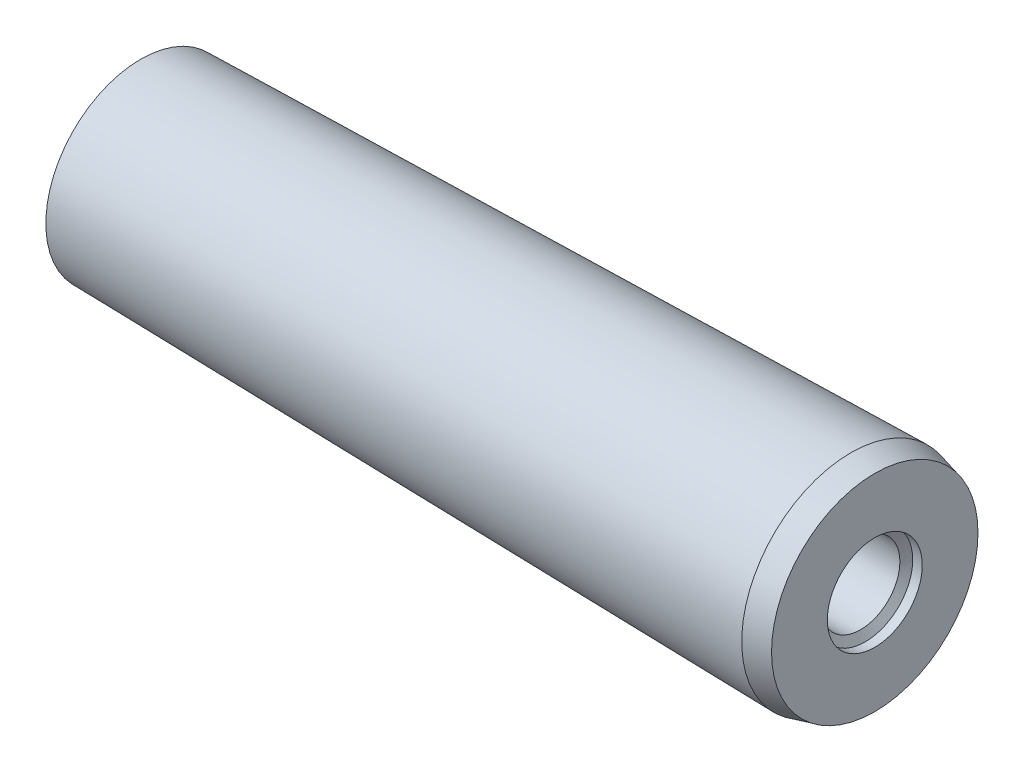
SolidWorks part; units mm, degrees
ref_plane "Front Plane" through (0, 0, 0) normal (0, 0, 1) x (1, 0, 0)
ref_plane "Top Plane" through (0, 0, 0) normal (0, 1, 0) x (1, 0, 0)
ref_plane "Right Plane" through (0, 0, 0) normal (1, 0, 0) x (0, 0, -1)
sketch "BodySke" plane through (0, 0, 0) normal (0, 0, 1) x (1, 0, 0)
  line L0 (0, 0) -> (-250, 0) construction
  line L1 (0, 0) -> (0, 5) construction
  line L2 (0, 5) -> (-250, 0) construction
  line L3 (-200, 0) -> (-55.9767, 0)
  line L4 (-6.3, 28.74) -> (-193.3013, 25)
  line L5 (-193.3013, 25) -> (-193.3013, 0) construction
  line L6 (0, 12.5) -> (-2.5, 12.5)
  line L7 (-2.5, 12.5) -> (-3.7401, 10.352)
  line L8 (-3.7401, 10.352) -> (-50, 10.352)
  line L9 (-50, 10.352) -> (-55.9767, 0)
  line L10 (-2.5, -12.5) -> (-3.7401, -10.352) construction
  line L11 (0, 27.1863) -> (-6.3, 28.74)
  line L12 (0, 12.5) -> (0, 27.1863)
  line L13 (-36, 0) -> (-36, 15.7679) construction
  line L14 (-3, 0) -> (-3, 4.94) construction
  arc A0 (-193.3013, 25) -> (-200, 0) centre (-150, 0) ccw
  point P5 (-36, 12)
  dimension "Round_end" = 50
  dimension "D1" = 5
  dimension "D2" = 250
  dimension "Nominal_dia" = 50
  dimension "Hole_dia" = 25
  dimension "Angle" = 120
  dimension "Depth" = 2.5
  dimension "Thread_minor" = 20.704
  dimension "Hole_angle" = 60
  dimension "Body_chamfer_angle" = 15
  dimension "Length" = 200
  dimension "Hole_length" = 50
  dimension "Chamfer_length" = 6.3
  dimension "Diameter" = 24
  dimension "Thread_length" = 36
  dimension "Advance" = 3
revolve "BaseBody" add sketch "BodySke" angle 360 about L0
sketch "ThdSchSke" plane through (0, 0, 0) normal (0, 0, 1) x (1, 0, 0)
  line L0 (0, 0) -> (-60.7083, 0) construction
  line L1 (-200, 0) -> (-55.9767, 0) construction
  line L2 (-6.7401, 8.4491) -> (-4.8372, 8.4491)
  line L3 (-4.8372, 8.4491) -> (-4.8372, 10.352)
  line L4 (-6.7401, 8.4491) -> (-6.7401, 10.352)
  line L5 (-6.7401, 10.352) -> (-5.7887, 12)
  line L6 (-5.7887, 12) -> (-4.8372, 10.352)
  line L7 (-3.7401, 10.352) -> (-50, 10.352) construction
  dimension "D1" = 3
revolve "ThreadSchematic" [suppressed] cut sketch "ThdSchSke" angle 360 about L0
pattern_linear "ThdSchPat" [suppressed]
equation "\"D1@ThreadCosmetic\" = \"Thread_length@BodySke\""
equation "\"D2@ThreadCosmetic\" = \"Thread_minor@BodySke\""
equation "\"D1@ThdSchSke\" = \"Advance@BodySke\""
equation "\"Advance@ThdSchPat\" = \"Advance@BodySke\""
equation "\"Tooth_Num@ThdSchPat\" =  int(  ( \"Thread_length@BodySke\" - \"Depth@BodySke\" )  / \"Advance@BodySke\" ) "
equation "\"Round_end@BodySke\" = \"Nominal_dia@BodySke\""
